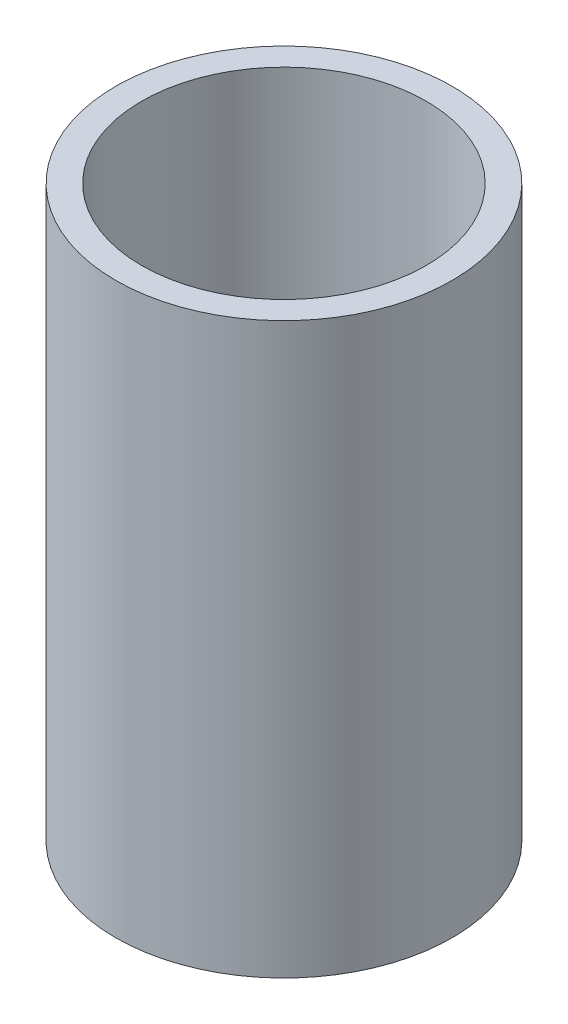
SolidWorks part; units mm, degrees
ref_plane "Front Plane" through (0, 0, 0) normal (0, 0, 1) x (1, 0, 0)
ref_plane "Top Plane" through (0, 0, 0) normal (0, 1, 0) x (1, 0, 0)
ref_plane "Right Plane" through (0, 0, 0) normal (1, 0, 0) x (0, 0, -1)
sketch "Sketch1" plane through (0, 0, 0) normal (0, 1, 0) x (1, 0, 0)
  circle A0 centre (0, 0) radius 3.25
  dimension "D1" = 6.5
extrude "Boss-Extrude1" add sketch "Sketch1" along normal blind 11
sketch "Sketch2" plane through (0, 11, 0) normal (0, 1, 0) x (1, 0, 0)
  circle A0 centre (0, 0) radius 2.75
  dimension "D1" = 5.5
extrude "Cut-Extrude2" cut sketch "Sketch2" against normal blind 11
